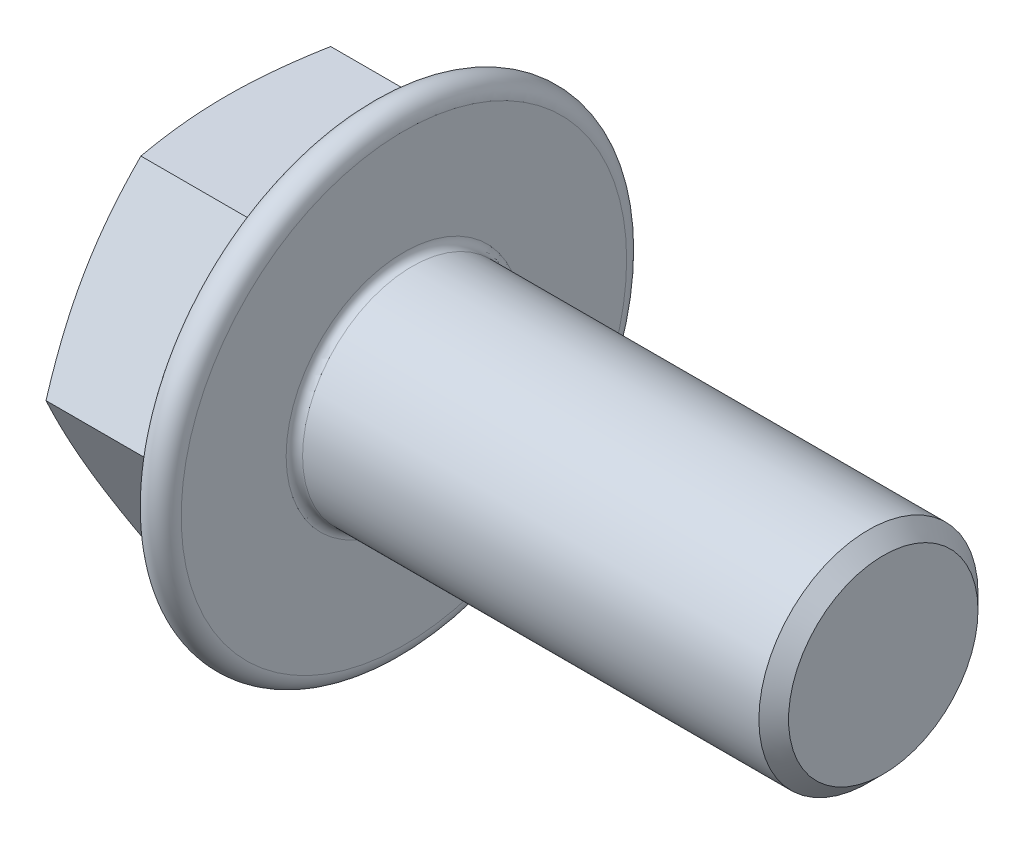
SolidWorks part; units mm, degrees
ref_plane "Front" through (0, 0, 0) normal (0, 0, 1) x (1, 0, 0)
ref_plane "Top" through (0, 0, 0) normal (0, 1, 0) x (1, 0, 0)
ref_plane "Right" through (0, 0, 0) normal (1, 0, 0) x (0, 0, -1)
sketch "Sketch1" plane through (0, 0, 0) normal (1, 0, 0) x (0, 0, -1)
  line L1 (13.8564, 0) -> (6.9282, 12)
  line L2 (6.9282, 12) -> (-6.9282, 12)
  line L3 (-6.9282, 12) -> (-13.8564, 0)
  line L4 (-13.8564, 0) -> (-6.9282, -12)
  line L5 (-6.9282, -12) -> (6.9282, -12)
  line L6 (6.9282, -12) -> (13.8564, 0)
  circle A0 centre (0, 0) radius 12 construction
  dimension "s" = 24
extrude "BaseHead" add sketch "Sketch1" along normal blind 14.1
ref_plane "Plane1" through (20.1, 0, 0) normal (1, 0, 0) x (0, 0, -1)
sketch "Sketch2" plane through (14.1, 0, 0) normal (1, 0, 0) x (0, 0, -1)
  circle A0 centre (0, 0) radius 8
  dimension "d" = 16
extrude "BaseBody" add sketch "Sketch2" along normal blind 35
sketch "Sketch3" plane through (-0.4952, 0, 6.2687) normal (0, 1, 0) x (0, 0, -1)
  line L0 (20.1251, -0.4952) -> (20.1251, -2.3174)
  line L2 (20.1251, -2.3174) -> (15.1187, -0.4952)
  line L4 (15.1187, -0.4952) -> (20.1251, -0.4952)
  line L5 (6.2687, 4.1693) -> (6.2687, -11.9236) construction
  dimension "D1" = 20
  dimension "da" = 17.7
revolve "HeadChamfer" cut sketch "Sketch3" angle 360 about L5
sketch "Sketch5" plane through (-0.1752, 0, 7.2752) normal (0, 1, 0) x (0, 0, -1)
  line L0 (7.2752, -14.2752) -> (7.2752, -7.1738) construction
  line L2 (7.2752, -14.2752) -> (23.5378, -14.2752)
  line L3 (23.961, -11.8752) -> (7.2752, -5.802)
  line L4 (7.2752, -5.802) -> (7.2752, -14.2752)
  line L7 (7.2752, 4.4893) -> (7.2752, -11.6035) construction
  arc A0 (23.5378, -14.2752) -> (23.961, -11.8752) centre (23.5378, -13.0378) ccw
  dimension "D3" = 20
  dimension "c" = 2.4
  dimension "dc" = 35
revolve "Flange" add sketch "Sketch5" angle 360 about L0
fillet "HeadFillet" radius 0.6 1 edges at (14.1, 0, 8)
fillet "FlangeHexFillet" radius 1 6 edges
chamfer "Chamfer1" distance 1.0825 angle 45 1 edges at (49.1, 0, -8)
equation "\"D1@Chamfer1\" = (  \"d@Sketch2\" - \"D2@ThreadCosmetic1\" )  / 2"
equation "\"b@ThreadCosmetic1\" = \"l@BaseBody\" - \"lg@Plane1\""
equation "\"da@Sketch3\" = \"s@Sketch1\""
